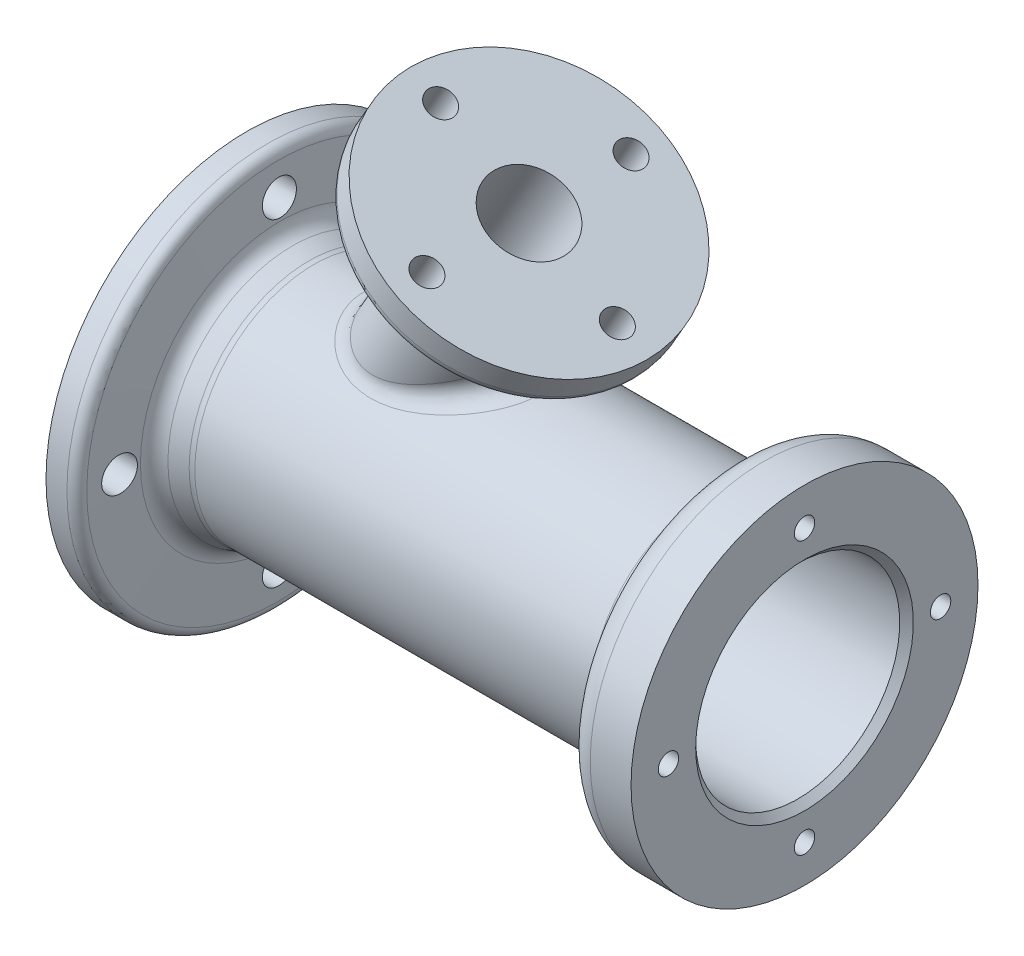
SolidWorks part; units mm, degrees
ref_plane "Plan de face" through (0, 0, 0) normal (0, 0, 1) x (1, 0, 0)
ref_plane "Plan de dessus" through (0, 0, 0) normal (0, 1, 0) x (1, 0, 0)
ref_plane "Plan de droite" through (0, 0, 0) normal (1, 0, 0) x (0, 0, -1)
sketch "Esquisse1" plane through (0, 0, 0) normal (0, 0, 1) x (1, 0, 0)
  line L0 (-94.239, 0) -> (136.3376, 0) construction
  line L1 (-40, 20) -> (-40, 56)
  line L2 (-37, 59) -> (-30.8469, 59)
  line L4 (-17.2662, 35) -> (99, 35)
  line L5 (130, 25) -> (130, 48)
  line L6 (127, 51) -> (115, 51)
  line L7 (130, 25) -> (-5, 25)
  line L8 (-27.851, 56.157) -> (-27.0661, 41.1804)
  line L9 (-23.5097, 36.6529) -> (-18.7029, 35.2109)
  line L11 (-10, 20) -> (-40, 20)
  arc A0 (115, 51) -> (107, 43) centre (115, 43) ccw
  arc A1 (99, 35) -> (107, 43) centre (99, 43) ccw
  arc A2 (-27.0661, 41.1804) -> (-23.5097, 36.6529) centre (-22.073, 41.442) ccw
  arc A3 (-17.2662, 35) -> (-18.7029, 35.2109) centre (-17.2662, 40) cw
  arc A4 (130, 48) -> (127, 51) centre (127, 48) ccw
  arc A5 (-40, 56) -> (-37, 59) centre (-37, 56) cw
  arc A6 (-5, 25) -> (-7.5, 22.5) centre (-5, 22.5) ccw
  arc A7 (-10, 20) -> (-7.5, 22.5) centre (-10, 22.5) ccw
  arc A8 (-27.851, 56.157) -> (-30.8469, 59) centre (-30.8469, 56) ccw
  point P17 (-28, 38)
  point P22 (-18, 35)
  point P27 (-40, 59)
  point P33 (-28, 59)
  dimension "D1" = 16
  dimension "D13" = 16.699
  dimension "D14" = 3
  dimension "D15" = 30
  dimension "D6" = 2.5
  dimension "D12" = 5
  dimension "D18" = 3
  dimension "D2" = 23
  dimension "D3" = 40
  dimension "D4" = 12
  dimension "D5" = 20
  dimension "D7" = 25
  dimension "D8" = 35
  dimension "D9" = 130
  dimension "D10" = 59
  dimension "D11" = 3
  dimension "D16" = 3
  dimension "D17" = 6.442
revolve "Révolution1" add sketch "Esquisse1" angle 360 about L0
sketch "Esquisse2" plane through (0, 0, 0) normal (0, 0, 1) x (1, 0, 0)
  line L0 (0, 0) -> (63.2662, 109.5802) construction
  line L1 (-94.239, 0) -> (136.3376, 0) construction
  line L2 (11.359, 99.6743) -> (46, 79.6743)
  line L3 (11.359, 99.6743) -> (7.7824, 93.4796)
  line L5 (46, 79.6743) -> (39.9518, 69.1986)
  line L6 (8.7466, 89.4636) -> (39.9518, 69.1986)
  arc A0 (7.7824, 93.4796) -> (8.7466, 89.4636) centre (10.3805, 91.9796) ccw
  point P11 (6.359, 91.0141)
  dimension "D6" = 3
  dimension "D1" = 60
  dimension "D2" = 92
  dimension "D3" = 3
  dimension "D4" = 40
  dimension "D5" = 10
revolve "Révolution2" add sketch "Esquisse2" angle 360 about L0
ref_plane "Plan1" through (41, 71.0141, 0) normal (0.5, 0.866, 0) x (-0.866, 0.5, 0)
sketch "Esquisse12" plane through (41, 71.0141, 0) normal (0.5, 0.866, 0) x (-0.866, 0.5, 0)
  circle A0 centre (0, 0) radius 17.5
  dimension "D1" = 35
extrude "Extrusion2" add sketch "Esquisse12" against normal up to surface (51.6891 mm away)
fillet "Congé1" radius 5 2 edges at (25.255, 78.7429, 0) (40.4101, 34.9985, 0.3277)
sketch "Esquisse4" plane through (46, 79.6743, 0) normal (0.5, 0.866, 0) x (-0.866, 0.5, 0)
  circle A0 centre (0, 0) radius 11.75
  dimension "D1" = 23.5
extrude "Enlèv. mat.-Extru.1" cut sketch "Esquisse4" against normal up to next
sketch "Esquisse6" plane through (0, 0, 0) normal (0, 0, 1) x (1, 0, 0)
  line L0 (-23, 20) -> (-23, 24)
  line L1 (-23, 24) -> (-7, 24)
  line L2 (-7, 24) -> (-7, 28)
  line L3 (-7, 28) -> (50, 28)
  line L4 (127, 32) -> (127, 81.1729)
  line L5 (127, 81.1729) -> (139.7787, 81.1729)
  line L6 (139.7787, 81.1729) -> (139.7787, 0)
  line L7 (139.7787, 0) -> (-50.4201, 0)
  line L8 (-50.4201, 0) -> (-50.4201, 59)
  line L9 (-10, 20) -> (-40, 20) construction
  line L10 (-23, 20) -> (-37, 20)
  line L11 (-50.4201, 59) -> (-37, 59)
  line L12 (-40, 56) -> (-40, -56) construction
  line L13 (-37, 59) -> (-37, 20)
  line L14 (-30.8469, 59) -> (-37, 59) construction
  line L15 (-94.239, 0) -> (136.3376, 0) construction
  line L18 (130, -48) -> (130, 48) construction
  line L19 (125, 30) -> (52, 30)
  line L20 (125, 30) -> (127, 32)
  line L21 (52, 30) -> (50, 28)
  point P24 (127, 30)
  dimension "D1" = 3
  dimension "D2" = 24
  dimension "D3" = 28
  dimension "D4" = 3
  dimension "D5" = 30
  dimension "D6" = 75
  dimension "D7" = 45
  dimension "D8" = 2
  dimension "D9" = 45
  dimension "D10" = 14
  dimension "D11" = 16
revolve "Enlèvement de matière-Révolution1" cut sketch "Esquisse6" angle 360 about axis through (-94.239, 0, 0) along (1, 0, 0)
sketch "Esquisse8" plane through (46, 79.6743, 0) normal (0.5, 0.866, 0) x (-0.866, 0.5, 0)
  line L0 (81.6134, 0) -> (-118.0718, 0) construction
  circle A0 centre (30, 0) radius 4
  circle A1 centre (0, 0) radius 11.75 construction
  dimension "D1" = 8
  dimension "D2" = 30
extrude "Enlèv. mat.-Extru.2" cut sketch "Esquisse8" against normal up to next
pattern_circular "Répétition circulaire1" count 4 over 360 about axis through (0, 0, 0) along (0.5, 0.866, 0) of "Enlèv. mat.-Extru.2"
sketch "Esquisse9" plane through (-37, 0, 0) normal (-1, 0, 0) x (0, 0, 1)
  line L0 (0, 33.875) -> (0, 79.6743) construction
  circle A0 centre (0, 47) radius 5
  circle A1 centre (0, 0) radius 20 construction
  dimension "D1" = 10
  dimension "D2" = 47
extrude "Enlèv. mat.-Extru.3" cut sketch "Esquisse9" against normal up to next
pattern_circular "Répétition circulaire2" count 4 over 360 about axis through (0, 0, 0) along (1, 0, 0) of "Enlèv. mat.-Extru.3"
hole_wizard "Trou taraudé M6x1.01" positions "Esquisse11" profile "Esquisse10" tap size "M6x1.0" standard "ISO"
sketch "Esquisse11" plane through (127, 0, 0) normal (1, 0, 0) x (0, 0, -1)
  line L0 (0, 33.875) -> (0, 79.6743) construction
  point P0 (0, 40)
  dimension "D1" = 40
sketch "Esquisse10" plane through (127, 40, 0) normal (0, 1, 0) x (0, 0, -1)
  line L0 (0, 0) -> (0, 15.5022)
  line L1 (0, 15.5022) -> (2.5, 14)
  line L2 (2.5, 14) -> (2.5, 11)
  line L3 (2.5, 11) -> (3, 11)
  line L4 (3, 11) -> (3, 0)
  line L5 (3, 0) -> (0, 0)
  line L10 (0, 15.5022) -> (-2.5, 14) construction
  line L11 (0, -6.35) -> (0, 107.95) construction
  dimension "Diamètre du trou pour taraudage" = 5
  dimension "Profondeur du trou pour taraudage" = 14
  dimension "Diamètre principal du filetage" = 6
  dimension "Profondeur du filetage" = 11
  dimension "Angle de pointe" = 118
pattern_circular "Répétition circulaire3" count 4 over 360 about axis through (0, 0, 0) along (1, 0, 0) of "Trou taraudé M6x1.01"
